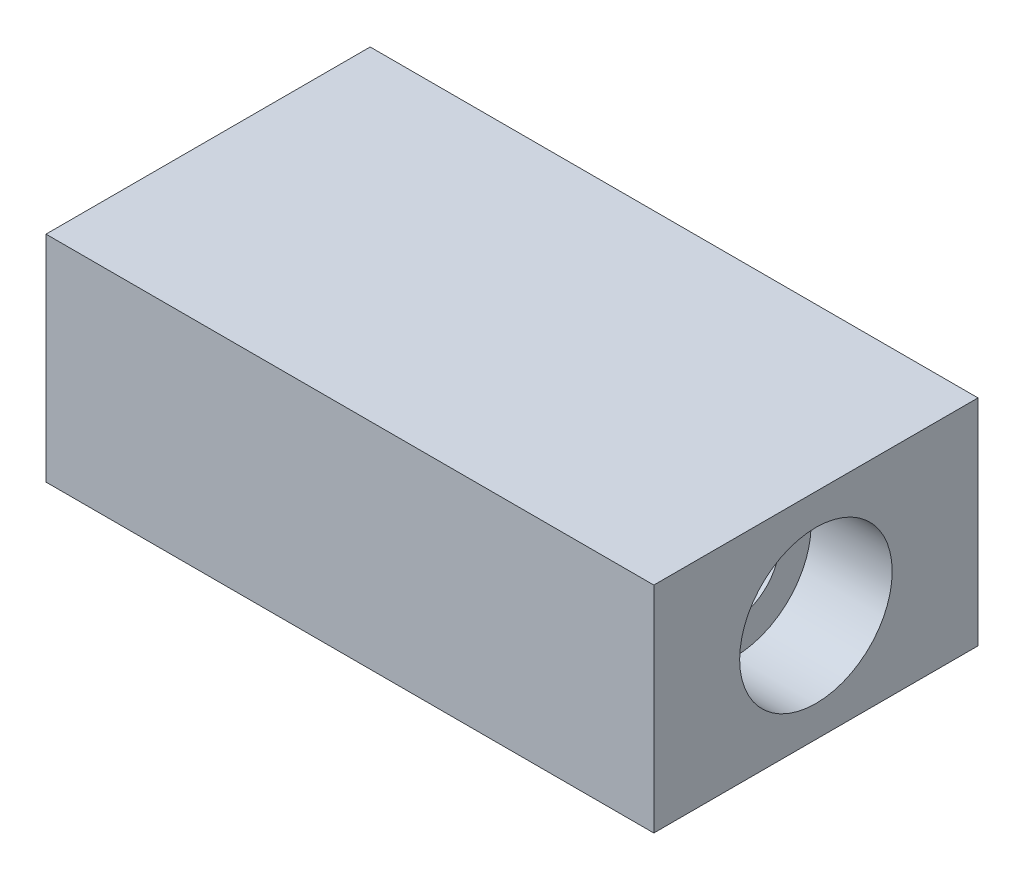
SolidWorks part; units mm, degrees
ref_plane "Front Plane" through (0, 0, 0) normal (0, 0, 1) x (1, 0, 0)
ref_plane "Top Plane" through (0, 0, 0) normal (0, 1, 0) x (1, 0, 0)
ref_plane "Right Plane" through (0, 0, 0) normal (1, 0, 0) x (0, 0, -1)
sketch "Sketch1" plane through (0, 0, 0) normal (0, 1, 0) x (1, 0, 0)
  line L1 (-75, -40) -> (75, -40)
  line L2 (-75, -40) -> (-75, 40)
  line L3 (-75, 40) -> (75, 40)
  line L4 (75, -40) -> (75, 40)
  line L5 (-75, -40) -> (75, 40) construction
  line L6 (-75, 40) -> (75, -40) construction
  point P0 (0, 0)
  dimension "D1" = 150
  dimension "D2" = 80
extrude "Boss-Extrude1" add sketch "Sketch1" along normal blind 53
other "AdvancedHole1" parameters "D0"=0, "D3"=0, "D2"=0
sketch "Sketch4" plane through (75, 0, 0) normal (1, 0, 0) x (0, 0, -1)
  line L0 (0, 53) -> (0, 0) construction
  line L1 (-40, 53) -> (40, 53) construction
  point P0 (0, 26.5)
  point P9 (0, 26.5)
sketch "Sketch5" plane through (75, 26.5, 0) normal (0, 0, 1) x (0, 1, 0)
  line L0 (0, 0) -> (0, 150)
  line L1 (0, -0.3556) -> (0, 1.0668) construction
  line L2 (18.82, 0) -> (18.82, 20)
  line L3 (0, 0) -> (18.82, 0)
  line L4 (11, 130) -> (11, 20)
  line L5 (18.82, 150) -> (18.82, 130)
  line L6 (18.82, 130) -> (11, 130)
  line L7 (0, 150) -> (18.82, 150)
  line L8 (11, 20) -> (18.82, 20)
  dimension "D1" = 20
  dimension "D2" = 37.64
  dimension "D3" = 110
  dimension "D4" = 22
  dimension "D5" = 20
  dimension "D6" = 37.64
